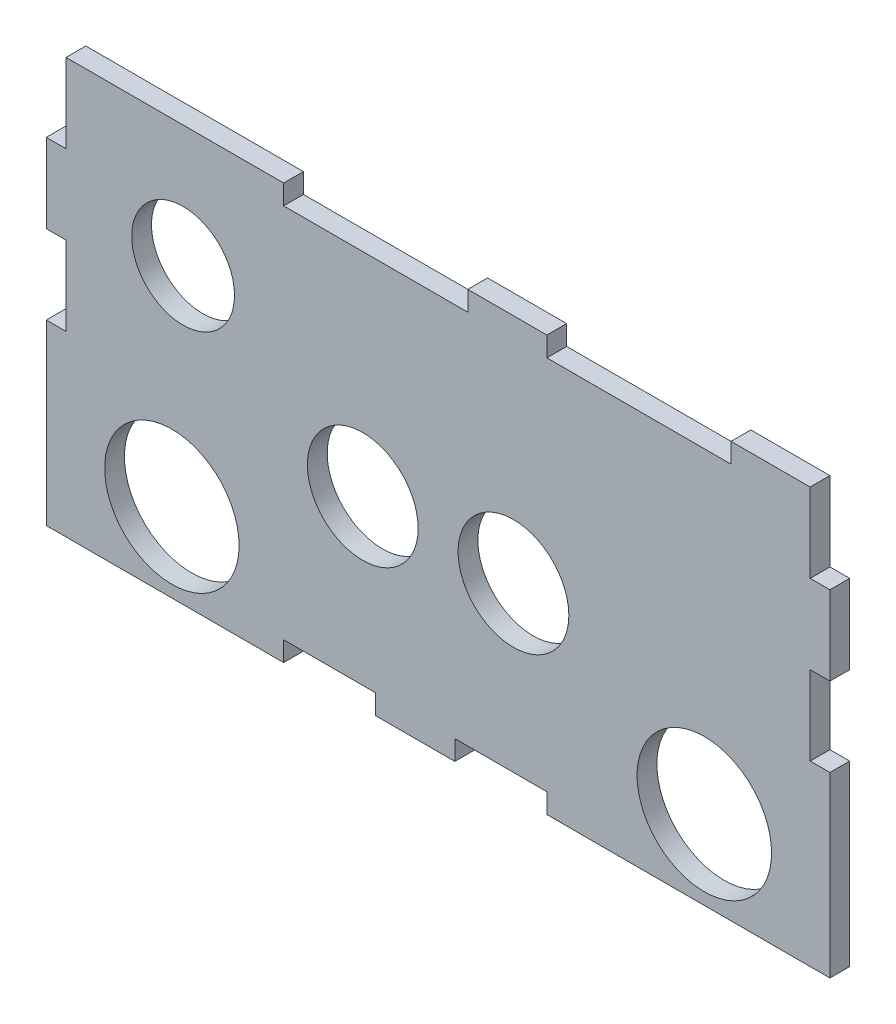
SolidWorks part; units mm, degrees
ref_plane "Front Plane" through (0, 0, 0) normal (0, 0, 1) x (1, 0, 0)
ref_plane "Top Plane" through (0, 0, 0) normal (0, 1, 0) x (1, 0, 0)
ref_plane "Right Plane" through (0, 0, 0) normal (1, 0, 0) x (0, 0, -1)
sketch "Sketch1" plane through (0, 0, 0) normal (0, 0, 1) x (1, 0, 0)
  line L0 (20.8422, 87.9243) -> (34.591, 74.1756) construction
  line L1 (0, 0) -> (198.12, 0) construction
  line L2 (0, 0) -> (0, 105) construction
  line L3 (0, 105) -> (198.12, 105) construction
  line L4 (198.12, 0) -> (198.12, 105) construction
  line L5 (34.591, 74.1756) -> (48.3398, 87.9243) construction
  line L6 (5, 105) -> (5, 0) construction
  line L7 (0, 0) -> (0, 45)
  line L8 (0, 45) -> (5, 45)
  line L9 (5, 45) -> (5, 65)
  line L10 (5, 65) -> (0, 65)
  line L11 (0, 65) -> (0, 85)
  line L12 (0, 85) -> (5, 85)
  line L13 (5, 85) -> (5, 105)
  line L14 (5, 105) -> (60, 105)
  line L15 (60, 105) -> (60, 100)
  line L16 (60, 100) -> (106.56, 100)
  line L17 (106.56, 100) -> (106.56, 105)
  line L18 (106.56, 105) -> (126.56, 105)
  line L19 (126.56, 105) -> (126.56, 100)
  line L20 (126.56, 100) -> (173.12, 100)
  line L21 (173.12, 100) -> (173.12, 105)
  line L22 (173.12, 105) -> (193.12, 105)
  line L23 (193.12, 105) -> (193.12, 85)
  line L24 (193.12, 85) -> (198.12, 85)
  line L25 (198.12, 85) -> (198.12, 65)
  line L26 (198.12, 65) -> (193.12, 65)
  line L27 (193.12, 65) -> (193.12, 45)
  line L28 (193.12, 45) -> (198.12, 45)
  line L29 (198.12, 45) -> (198.12, 0)
  line L30 (0, 0) -> (60, 0)
  line L31 (60, 0) -> (60, 5)
  line L32 (60, 5) -> (83.28, 5)
  line L33 (83.28, 5) -> (83.28, 0)
  line L34 (83.28, 0) -> (103.28, 0)
  line L35 (103.28, 0) -> (103.28, 5)
  line L36 (103.28, 5) -> (126.56, 5)
  line L37 (126.56, 5) -> (126.56, 0)
  line L38 (126.56, 0) -> (198.12, 0)
  circle A0 centre (31.75, 20) radius 17
  circle A1 centre (80.01, 46.3813) radius 14
  circle A2 centre (118.11, 46.3813) radius 14
  circle A3 centre (166.37, 20) radius 17
  circle A4 centre (31.75, 20) radius 55 construction
  circle A5 centre (31.75, 20) radius 31.75 construction
  circle A6 centre (166.37, 20) radius 55 construction
  circle A7 centre (166.37, 20) radius 31.75 construction
  circle A8 centre (31.75, 20) radius 54.25 construction
  circle A9 centre (34.591, 74.1756) radius 19.4437 construction
  circle A10 centre (20.8422, 87.9243) radius 3 construction
  circle A11 centre (20.8422, 60.4268) radius 3 construction
  circle A12 centre (48.3398, 60.4268) radius 3 construction
  circle A13 centre (48.3398, 87.9243) radius 3 construction
  circle A14 centre (34.591, 74.1756) radius 29.591 construction
  circle A15 centre (34.591, 74.1756) radius 13
  dimension "D1" = 63.5
  dimension "D5" = 110
  dimension "D8" = 108.5
  dimension "D9" = 38.8874
  dimension "D10" = 6
  dimension "D11" = 59.182
  dimension "D21" = 26
  dimension "D23" = 28
  dimension "D24" = 34
  dimension "D3" = 38.1
  dimension "D4" = 134.62
  dimension "D6" = 198.12
  dimension "D7" = 105
  dimension "D12" = 20
  dimension "D13" = 5
  dimension "D14" = 20
  dimension "D15" = 20
  dimension "D16" = 45
  dimension "D17" = 20
  dimension "D18" = 20
  dimension "D19" = 55
  dimension "D20" = 5
  dimension "D22" = 20
extrude "Boss-Extrude1" add sketch "Sketch1" along normal blind 5
